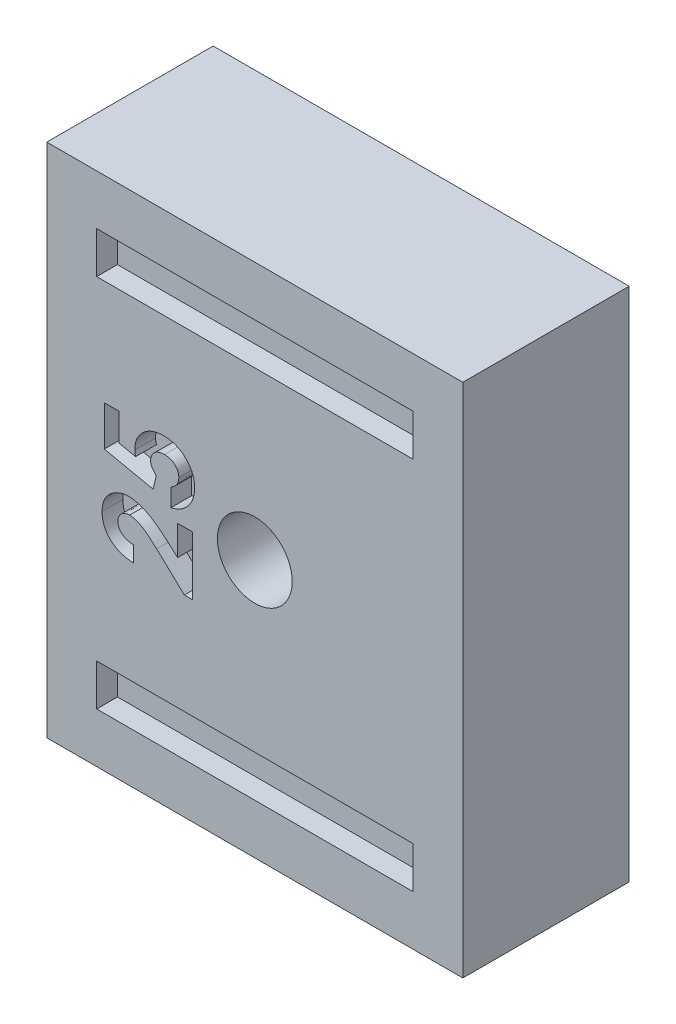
SolidWorks part; units mm, degrees
ref_plane "Front Plane" through (0, 0, 0) normal (0, 0, 1) x (1, 0, 0)
ref_plane "Top Plane" through (0, 0, 0) normal (0, 1, 0) x (1, 0, 0)
ref_plane "Right Plane" through (0, 0, 0) normal (1, 0, 0) x (0, 0, -1)
sketch "Sketch1" plane through (0, 0, 0) normal (0, 0, 1) x (1, 0, 0)
  line L1 (-12.2454, 6.5291) -> (7.7546, 6.5291)
  line L2 (-12.2454, 6.5291) -> (-12.2454, -18.2709)
  line L3 (-12.2454, -18.2709) -> (7.7546, -18.2709)
  line L4 (7.7546, 6.5291) -> (7.7546, -18.2709)
  circle A0 centre (-2.2454, -5.8709) radius 1.8
  point P6 (-12.2454, -5.8709)
  dimension "D3" = 3.6
  dimension "D1" = 24.8
  dimension "D2" = 20
  dimension "D4" = 10
extrude "Boss-Extrude1" add sketch "Sketch1" along normal blind 8
ref_plane "Plane1" through (0, 0, 8) normal (0, 0, 1) x (1, 0, 0)
sketch "Sketch3" plane through (0, 0, 8) normal (0, 0, 1) x (1, 0, 0)
  line L0 (-5.2454, -18.2709) -> (-5.2454, 6.5291) construction
  line L1 (-12.2454, -18.2709) -> (7.7546, -18.2709) construction
  line L2 (7.7546, 6.5291) -> (-12.2454, 6.5291) construction
  line L3 (7.7546, -18.2709) -> (7.7546, 6.5291) construction
  text T0 "25" font "Century Gothic" height in points 16
  dimension "D1" = 13
extrude "Cut-Extrude1" cut sketch "Sketch3" against normal blind 1
sketch "Sketch4" plane through (0, 0, 8) normal (0, 0, 1) x (1, 0, 0)
  line L0 (-12.2454, -18.2709) -> (7.7546, -18.2709) construction
  line L1 (-9.8454, -15.8709) -> (5.3546, -15.8709)
  line L2 (-9.8454, -15.8709) -> (-9.8454, -13.8709)
  line L3 (-9.8454, -13.8709) -> (5.3546, -13.8709)
  line L4 (5.3546, -15.8709) -> (5.3546, -13.8709)
  line L5 (-9.8454, 2.1291) -> (5.3546, 2.1291)
  line L6 (-9.8454, 2.1291) -> (-9.8454, 4.1291)
  line L7 (-9.8454, 4.1291) -> (5.3546, 4.1291)
  line L8 (5.3546, 2.1291) -> (5.3546, 4.1291)
  line L9 (7.7546, 6.5291) -> (-12.2454, 6.5291) construction
  line L10 (-12.2454, 6.5291) -> (-12.2454, -18.2709) construction
  line L11 (7.7546, -18.2709) -> (7.7546, 6.5291) construction
  point P14 (5.3546, -14.8709)
  point P17 (5.3546, 3.1291)
  dimension "D1" = 2.4
  dimension "D2" = 2.4
  dimension "D3" = 2.4
  dimension "D4" = 2.4
  dimension "D5" = 2.4
  dimension "D6" = 2.4
  dimension "D7" = 2
  dimension "D8" = 2
extrude "Cut-Extrude2" cut sketch "Sketch4" against normal blind 1
